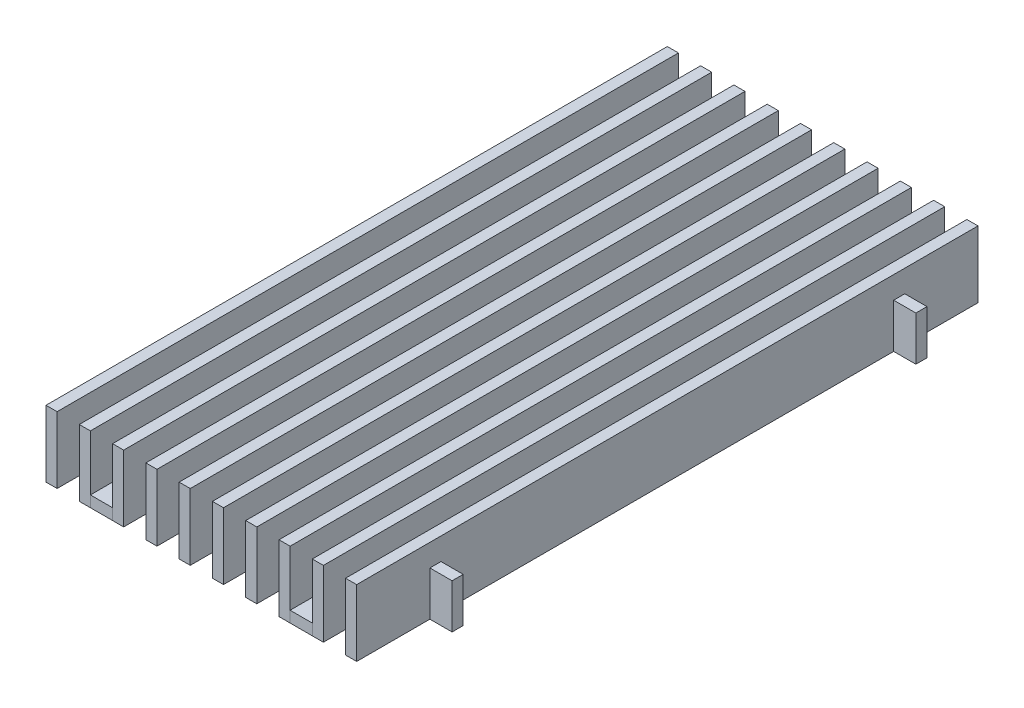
SolidWorks part; units mm, degrees
ref_plane "Front Plane" through (0, 0, 0) normal (0, 0, 1) x (1, 0, 0)
ref_plane "Top Plane" through (0, 0, 0) normal (0, 1, 0) x (1, 0, 0)
ref_plane "Right Plane" through (0, 0, 0) normal (1, 0, 0) x (0, 0, -1)
sketch "Sketch1" plane through (0, 0, 0) normal (0, 0, 1) x (1, 0, 0)
  line L1 (1.5875, -9.525) -> (-1.5875, -9.525)
  line L2 (1.5875, -9.525) -> (1.5875, 9.525)
  line L3 (1.5875, 9.525) -> (-1.5875, 9.525)
  line L4 (-1.5875, -9.525) -> (-1.5875, 9.525)
  line L5 (1.5875, -9.525) -> (-1.5875, 9.525) construction
  line L6 (1.5875, 9.525) -> (-1.5875, -9.525) construction
  point P0 (0, 0)
  dimension "D1" = 3.175
  dimension "D2" = 19.05
extrude "Boss-Extrude1" add sketch "Sketch1" against normal blind 177.8
pattern_linear "LPattern1" count 10 spacing 9.525 along (1, 0, 0)
ref_plane "Plane1" through (42.8625, 0, 0) normal (-1, 0, 0) x (0, 0, 1)
sketch "Sketch2" plane through (42.8625, 0, 0) normal (-1, 0, 0) x (0, 0, 1)
  line L0 (-177.8, -9.525) -> (0, -9.525) construction
  line L1 (-156.845, -9.525) -> (-153.67, -9.525)
  line L2 (-156.845, -9.525) -> (-156.845, 3.175)
  line L3 (-156.845, 3.175) -> (-153.67, 3.175)
  line L4 (-153.67, -9.525) -> (-153.67, 3.175)
  line L5 (-88.9, 9.525) -> (-88.9, -9.525) construction
  line L6 (-177.8, 9.525) -> (0, 9.525) construction
  line L7 (-24.13, -9.525) -> (-24.13, 3.175)
  line L8 (-20.955, 3.175) -> (-24.13, 3.175)
  line L9 (-20.955, -9.525) -> (-20.955, 3.175)
  line L10 (-20.955, -9.525) -> (-24.13, -9.525)
  dimension "D1" = 12.7
  dimension "D2" = 3.175
  dimension "D3" = 64.77
extrude "Boss-Extrude2" add sketch "Sketch2" along normal mid plane 101.6
ref_plane "Plane2" through (0, 0, -88.9) normal (0, 0, 1) x (1, 0, 0)
sketch "Sketch3" plane through (0, -9.525, 0) normal (0, -1, 0) x (1, 0, 0)
  line L0 (42.8625, 9.593) -> (42.8625, -237.5141) construction
  line L1 (42.8625, 10.4775) -> (42.8625, -10.4775) construction
  line L2 (-1.5875, -88.9) -> (133.7758, -88.9) construction
  line L3 (-1.5875, -153.67) -> (-1.5875, -24.13) construction
  line L4 (1.7463, -88.9) -> (-1.7463, -88.9) construction
  line L5 (17.4625, -177.8) -> (17.4625, -156.845) construction
  line L6 (11.1125, -177.8) -> (17.4625, -177.8)
  line L7 (11.1125, -177.8) -> (11.1125, -165.1)
  line L8 (11.1125, -165.1) -> (17.4625, -165.1)
  line L9 (17.4625, -177.8) -> (17.4625, -165.1)
  line L10 (14.2875, -165.1) -> (14.2875, -177.8) construction
  line L11 (11.1125, -171.45) -> (17.4625, -171.45) construction
  line L12 (74.6125, -171.45) -> (68.2625, -171.45) construction
  line L13 (71.4375, -165.1) -> (71.4375, -177.8) construction
  line L14 (68.2625, -177.8) -> (68.2625, -165.1)
  line L15 (74.6125, -165.1) -> (68.2625, -165.1)
  line L16 (74.6125, -177.8) -> (74.6125, -165.1)
  line L17 (74.6125, -177.8) -> (68.2625, -177.8)
  line L18 (71.4375, -12.7) -> (71.4375, 0) construction
  line L19 (74.6125, -6.35) -> (68.2625, -6.35) construction
  line L20 (11.1125, -6.35) -> (17.4625, -6.35) construction
  line L21 (14.2875, -12.7) -> (14.2875, 0) construction
  line L22 (74.6125, 0) -> (68.2625, 0)
  line L23 (74.6125, 0) -> (74.6125, -12.7)
  line L24 (74.6125, -12.7) -> (68.2625, -12.7)
  line L25 (68.2625, 0) -> (68.2625, -12.7)
  line L26 (17.4625, 0) -> (17.4625, -12.7)
  line L27 (11.1125, -12.7) -> (17.4625, -12.7)
  line L28 (11.1125, 0) -> (11.1125, -12.7)
  line L29 (11.1125, 0) -> (17.4625, 0)
  circle A0 centre (14.2875, -171.45) radius 1.5875
  circle A1 centre (71.4375, -171.45) radius 1.5875
  circle A2 centre (71.4375, -6.35) radius 1.5875
  circle A3 centre (14.2875, -6.35) radius 1.5875
  dimension "D2" = 3.175
  dimension "D1" = 12.7
extrude "Boss-Extrude3" add sketch "Sketch3" against normal blind 3.175 separate body
